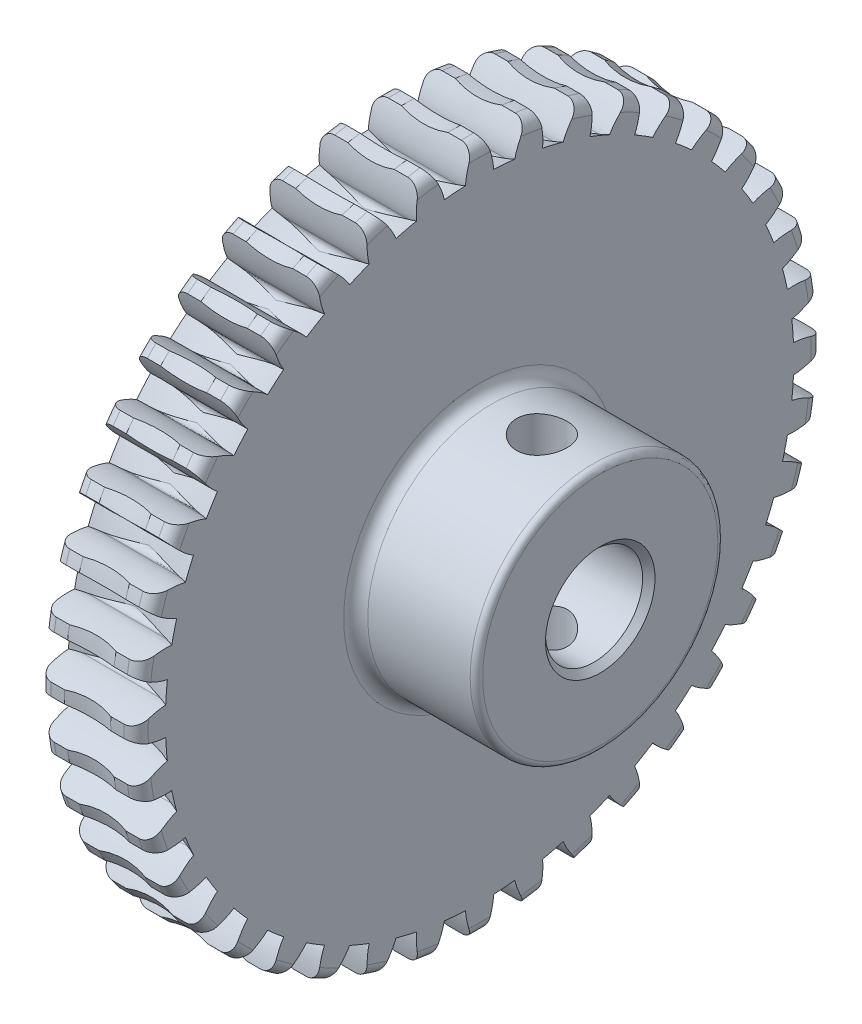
SolidWorks part; units mm, degrees
ref_plane "Front Plane" through (0, 0, 0) normal (0, 0, 1) x (1, 0, 0)
ref_plane "Top Plane" through (0, 0, 0) normal (0, 1, 0) x (1, 0, 0)
ref_plane "Right Plane" through (0, 0, 0) normal (1, 0, 0) x (0, 0, -1)
imported_body "Imported3"
sketch "Sketch1" plane through (0, 0, 0) normal (0, 0, 1) x (1, 0, 0)
  line L0 (3.175, 8.0962) -> (3.175, 0)
  line L1 (3.175, 0) -> (11.0617, 0)
  line L2 (11.0617, 0) -> (11.0617, 8.0962)
  line L3 (11.0617, 8.0962) -> (3.175, 8.0962)
  line L4 (3.175, 0) -> (11.0617, 0) construction
revolve "Revolve1" add sketch "Sketch1" angle 360 about L4
hole_wizard "1/4 (0.25) Diameter Hole1" positions "Sketch3" profile "Sketch2" hole size "1/4" standard "ANSI Inch"
sketch "Sketch3" plane through (11.0617, 0, 0) normal (1, 0, 0) x (0, 0, -1)
  point P0 (0, 0)
sketch "Sketch2" plane through (11.0617, 0, 0) normal (0, 1, 0) x (0, 0, -1)
  line L0 (0, 0) -> (0, 14.2367)
  line L1 (0, 14.2367) -> (3.175, 14.2367)
  line L2 (3.175, 14.2367) -> (3.175, 0)
  line L5 (3.175, 0) -> (0, 0)
  line L11 (0, -6.35) -> (0, 107.95) construction
  dimension "Thru Hole Dia." = 6.35
  dimension "Thru Hole Depth" = 14.2367
chamfer "Chamfer1" distance 0.4064 angle 45 2 edges at (-3.175, 0, -3.175) (11.0617, 0, -3.175)
fillet "Fillet1" radius 0.4064 1 edges at (11.0617, 0, -8.0962)
fillet "Fillet2" radius 0.7874 81 edges at (-3.175, -21.3486, -6.9366) (-3.175, 13.1942, 18.1602) (-3.175, 21.3486, -6.9366) (3.175, 21.3486, 6.9366) (-3.175, -13.1942, 18.1602) (3.175, 20.0006, 10.1908) (-3.175, 0, -22.4472) (3.175, 18.1602, 13.1942) (-3.175, 21.3486, 6.9366) (3.175, 15.8726, 15.8726) (-3.175, 0, 22.4472) (3.175, 13.1942, 18.1602) (-3.175, -21.3486, 6.9366) (3.175, 10.1908, 20.0006) (-3.175, -13.1942, -18.1602) (3.175, 6.9366, 21.3486) (-3.175, 13.1942, -18.1602) (3.175, 3.5115, 22.1709) (-3.175, 22.4473, 0) (3.175, 0, 22.4472) (-3.175, 18.1602, 13.1942) (3.175, -3.5115, 22.1709) (-3.175, 6.9366, 21.3486) (3.175, -6.9366, 21.3486) (-3.175, -6.9366, 21.3486) (3.175, -10.1908, 20.0006) (-3.175, -18.1602, 13.1942) (3.175, -13.1942, 18.1602) (-3.175, -22.4472, 0) (3.175, -15.8726, 15.8726) (-3.175, -18.1602, -13.1942) (3.175, -18.1602, 13.1942) (-3.175, -6.9366, -21.3486) (3.175, -20.0006, 10.1908) (-3.175, 6.9366, -21.3486) (3.175, -21.3486, 6.9366) (-3.175, 18.1602, -13.1942) (3.175, -22.1709, 3.5115) (3.175, 0, -8.0962) (3.175, -22.4472, 0) (-3.175, 22.1709, 3.5115) (3.175, -22.1709, -3.5115) (-3.175, 20.0006, 10.1908) (3.175, -21.3486, -6.9366) (-3.175, 15.8726, 15.8726) (3.175, -20.0006, -10.1908) (-3.175, 10.1908, 20.0006) (3.175, -18.1602, -13.1942) (-3.175, 3.5115, 22.1709) (3.175, -15.8726, -15.8726) (-3.175, -3.5115, 22.1709) (3.175, -13.1942, -18.1602) (-3.175, -10.1908, 20.0006) (3.175, -10.1908, -20.0006) (-3.175, -15.8726, 15.8726) (3.175, -6.9366, -21.3486) (-3.175, -20.0006, 10.1908) (3.175, -3.5115, -22.1709) (-3.175, -22.1709, 3.5115) (3.175, 0, -22.4472) (-3.175, -22.1709, -3.5115) (3.175, 3.5115, -22.1709) (-3.175, -20.0006, -10.1908) (3.175, 6.9366, -21.3486) (-3.175, -15.8726, -15.8726) (3.175, 10.1908, -20.0006) (-3.175, -10.1908, -20.0006) (3.175, 13.1942, -18.1602) (-3.175, -3.5115, -22.1709) (3.175, 15.8726, -15.8726) (-3.175, 3.5115, -22.1709) (3.175, 18.1602, -13.1942) (-3.175, 10.1908, -20.0006) (3.175, 20.0006, -10.1908) (-3.175, 15.8726, -15.8726) (3.175, 21.3486, -6.9366) (-3.175, 20.0006, -10.1908) (3.175, 22.1709, -3.5115) (-3.175, 22.1709, -3.5115) (3.175, 22.4472, 0) (3.175, 22.1709, 3.5115)
sketch "Sketch4" plane through (0, 0, 0) normal (0, 1, 0) x (1, 0, 0)
  line L0 (11.0617, -7.6899) -> (11.0617, 7.6899) construction
  circle A0 centre (7.2517, 0) radius 1.651
  point P4 (0, 0)
  dimension "D1" = 3.302
  dimension "D2" = 3.81
extrude "Cut-Extrude1" cut sketch "Sketch4" against normal through all and the other way through all
